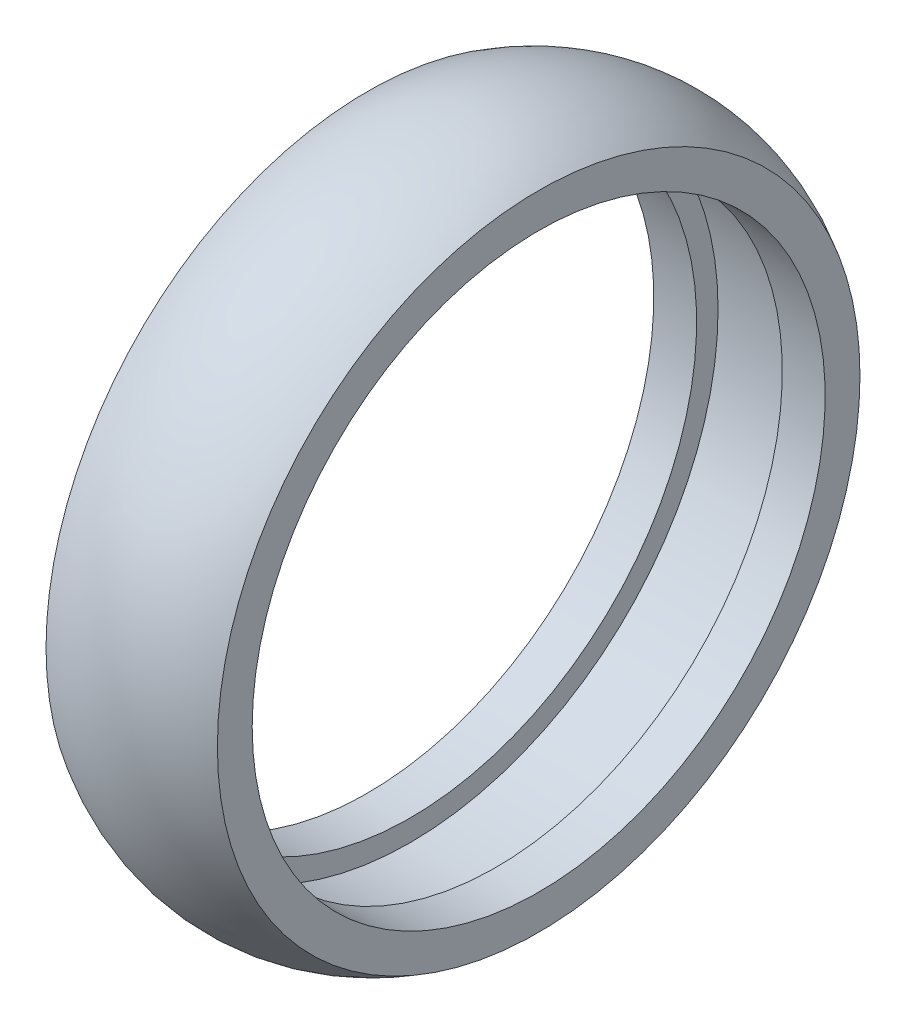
SolidWorks part; units mm, degrees
ref_plane "Plan de face" through (0, 0, 0) normal (0, 0, 1) x (1, 0, 0)
ref_plane "Plan de dessus" through (0, 0, 0) normal (0, 1, 0) x (1, 0, 0)
ref_plane "Plan de droite" through (0, 0, 0) normal (1, 0, 0) x (0, 0, -1)
sketch "Esquisse2" plane through (0, 0, 0) normal (0, 0, 1) x (1, 0, 0)
  line L0 (-8, 30) -> (-8, 26.75)
  line L1 (-8, 26.75) -> (-4, 26.75)
  line L2 (-4, 26.75) -> (-4, 28.75)
  line L3 (-4, 28.75) -> (4, 28.75)
  line L4 (4, 28.75) -> (4, 26.75)
  line L5 (4, 26.75) -> (8, 26.75)
  line L6 (8, 26.75) -> (8, 30)
  line L7 (0, 0) -> (0, 28.75) construction
  line L8 (0, 0) -> (8.7015, 0) construction
  line L9 (0, 28.75) -> (0, 32.25) construction
  arc A0 (8, 30) -> (-8, 30) centre (0, 16.9028) ccw
  dimension "D1" = 8
  dimension "D2" = 57.5
  dimension "D3" = 53.5
  dimension "D4" = 60
  dimension "D5" = 64.5
  dimension "D6" = 16
revolve "Révolution1" add sketch "Esquisse2" angle 360 about L8
